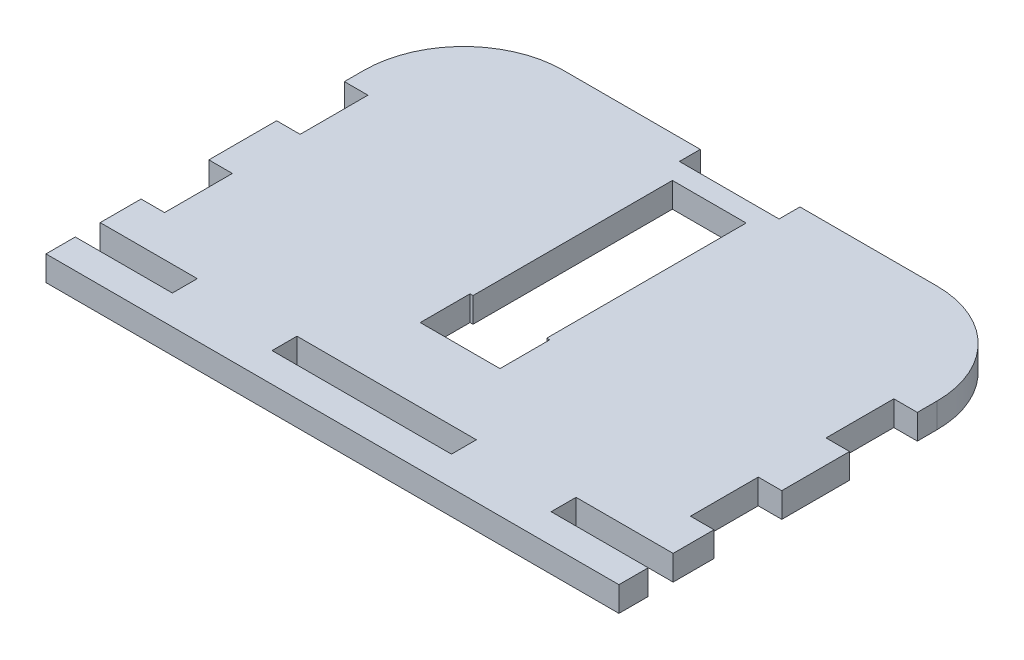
SolidWorks part; units mm, degrees
ref_plane "Front Plane" through (0, 0, 0) normal (0, 0, 1) x (1, 0, 0)
ref_plane "Top Plane" through (0, 0, 0) normal (0, 1, 0) x (1, 0, 0)
ref_plane "Right Plane" through (0, 0, 0) normal (1, 0, 0) x (0, 0, -1)
sketch "Sketch1" plane through (0, 0, 0) normal (0, 1, 0) x (1, 0, 0)
  line L0 (-36.5, 2.018) -> (-36.5, 10.654)
  line L1 (-11.43, -15) -> (11.43, -15)
  line L2 (36.5, -11.825) -> (36.5, -6.618)
  line L3 (0, 29.281) -> (-4.699, 29.281)
  line L4 (-36.5, -11.825) -> (-36.5, -6.618)
  line L5 (0, 29.281) -> (4.699, 29.281)
  line L6 (0, 31.821) -> (-6.35, 31.821)
  line L7 (-6.35, 34.4846) -> (-6.35, 31.821)
  line L8 (0, 31.821) -> (6.35, 31.821)
  line L9 (6.35, 34.4846) -> (6.35, 31.821)
  line L10 (-4.699, 29.281) -> (-4.699, -2.469)
  line L11 (-4.699, -2.469) -> (4.699, -2.469)
  line L12 (4.699, 29.281) -> (4.699, -2.469)
  line L13 (-6.35, 34.4846) -> (-23.8, 34.4846)
  line L14 (-33.5028, -6.618) -> (-33.5028, 2.018)
  line L15 (0, -18.7309) -> (0, 31.821) construction
  line L16 (36.5, 19.29) -> (36.5, 21.7846)
  line L17 (-36.5, 10.654) -> (-33.5028, 10.654)
  line L18 (33.5028, -11.825) -> (36.5, -11.825)
  line L19 (33.5028, 19.29) -> (36.5, 19.29)
  line L20 (-33.5028, 10.654) -> (-33.5028, 19.29)
  line L21 (6.35, 34.4846) -> (23.8, 34.4846)
  line L22 (36.5, 2.018) -> (33.5028, 2.018)
  line L23 (-24.13, -15) -> (-36.5, -15)
  line L24 (-36.5, -6.618) -> (-33.5028, -6.618)
  line L25 (-33.5028, -11.825) -> (-36.5, -11.825)
  line L26 (-36.5, -15) -> (-36.5, -18.7309)
  line L27 (-36.5, 2.018) -> (-33.5028, 2.018)
  line L28 (-33.5028, 19.29) -> (-36.5, 19.29)
  line L29 (-36.5, -18.7309) -> (36.5, -18.7309)
  line L30 (-24.13, -15) -> (-24.13, -11.825)
  line L31 (-11.43, -11.825) -> (-11.43, -15)
  line L32 (-24.13, -11.825) -> (-33.5028, -11.825)
  line L33 (24.13, -11.825) -> (33.5028, -11.825)
  line L34 (11.43, -11.825) -> (11.43, -15)
  line L35 (24.13, -15) -> (24.13, -11.825)
  line L36 (-11.43, -11.825) -> (11.43, -11.825)
  line L37 (36.5, -6.618) -> (33.5028, -6.618)
  line L38 (36.5, -18.7309) -> (36.5, -15)
  line L39 (36.5, -15) -> (24.13, -15)
  line L40 (-36.5, 19.29) -> (-36.5, 21.7846)
  line L41 (33.5028, 10.654) -> (33.5028, 19.29)
  line L42 (36.5, 10.654) -> (33.5028, 10.654)
  line L43 (33.5028, -6.618) -> (33.5028, 2.018)
  line L44 (36.5, 2.018) -> (36.5, 10.654)
  arc A0 (-23.8, 34.4846) -> (-36.5, 21.7846) centre (-23.8, 21.7846) ccw
  arc A1 (23.8, 34.4846) -> (36.5, 21.7846) centre (23.8, 21.7846) cw
  point P0 (0, 0)
  dimension "D1" = 12.7
  dimension "D2" = 8.636
  dimension "D3" = 9.398
  dimension "D4" = 12.7
  dimension "D5" = 12.7
  dimension "D6" = 31.75
  dimension "D9" = 3.175
extrude "Extrude1" add sketch "Sketch1" along normal blind 3.175
sketch "Sketch2" plane through (0, 3.175, 0) normal (0, 1, 0) x (1, 0, 0)
  line L0 (5.08, -2.469) -> (-5.08, -2.469)
  line L2 (5.08, -2.469) -> (5.08, 3.8774)
  line L4 (5.08, 3.8774) -> (-5.08, 3.8774)
  line L5 (-4.699, -2.469) -> (4.699, -2.469) construction
  line L6 (0, -2.469) -> (0, 3.8774) construction
  line L7 (-5.08, -2.469) -> (-5.08, 3.8774)
  dimension "D1" = 10.16
extrude "Extrude2" cut sketch "Sketch2" against normal through all
